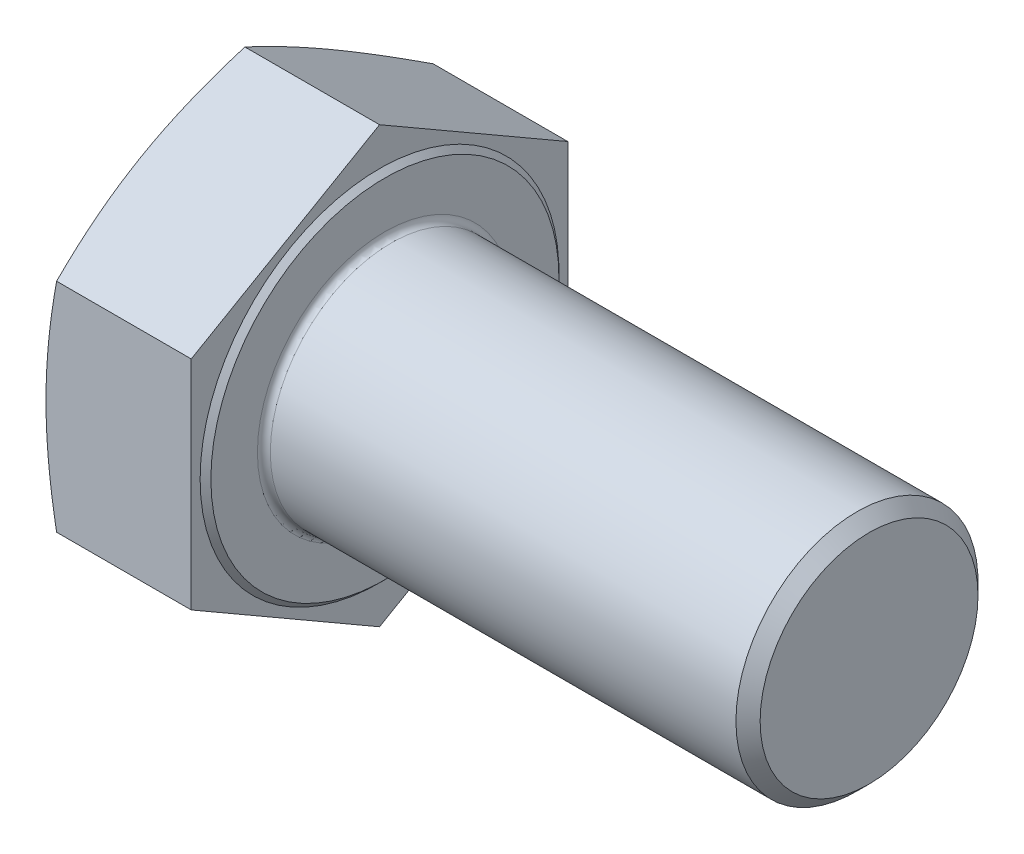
SolidWorks part; units mm, degrees
ref_plane "Front" through (0, 0, 0) normal (0, 0, 1) x (1, 0, 0)
ref_plane "Top" through (0, 0, 0) normal (0, 1, 0) x (1, 0, 0)
ref_plane "Right" through (0, 0, 0) normal (1, 0, 0) x (0, 0, -1)
sketch "Sketch2" plane through (0, 0, 0) normal (1, 0, 0) x (0, 0, -1)
  line L1 (0, -40.4145) -> (35, -20.2073)
  line L2 (35, -20.2073) -> (35, 20.2073)
  line L3 (35, 20.2073) -> (0, 40.4145)
  line L4 (0, 40.4145) -> (-35, 20.2073)
  line L5 (-35, 20.2073) -> (-35, -20.2073)
  line L6 (-35, -20.2073) -> (0, -40.4145)
  circle A0 centre (0, 0) radius 35 construction
  dimension "s" = 70
extrude "BaseHead" add sketch "Sketch2" along normal blind 28
sketch "Sketch3" plane through (0, 0, 0) normal (0, 0, 1) x (1, 0, 0)
  line L0 (28, 40.4145) -> (28, 32.35)
  line L2 (28, 32.35) -> (27, 33.35)
  line L3 (27, 33.35) -> (27, 40.4145)
  line L5 (27, 40.4145) -> (28, 40.4145)
  line L6 (-0.9571, 0) -> (7.6478, 0) construction
  line L7 (28, 40.4145) -> (0, 40.4145) construction
  dimension "D1" = 45
  dimension "c" = 1
  dimension "dw" = 64.7
revolve "BearingFace" cut sketch "Sketch3" angle 360 about L6
sketch "Sketch4" plane through (0, 0, 0) normal (0, 0, 1) x (1, 0, 0)
  line L0 (-0.4935, 0) -> (3.5626, 0) construction
  line L2 (0, 40.4145) -> (1.9707, 40.4145)
  line L4 (1.9707, 40.4145) -> (0, 35)
  line L6 (0, 35) -> (0, 40.4145)
  line L7 (27, 40.4145) -> (0, 40.4145) construction
  dimension "D1" = 20
  dimension "D2" = 70
revolve "HeadChamfer" cut sketch "Sketch4" angle 360 about L0
sketch "Sketch5" plane through (28, 0, 0) normal (1, 0, 0) x (0, 0, -1)
  circle A0 centre (0, 0) radius 22.5
  dimension "d" = 45
extrude "BaseBody" add sketch "Sketch5" along normal blind 90
chamfer "Chamfer1" distance 2.25 angle 45 1 edges at (118, 0, -22.5)
fillet "HeadFillet" radius 1.2 1 edges at (28, 0, 22.5)
equation "\"D2@Sketch4\" = \"s@Sketch2\""
equation "\"D1@Chamfer1\" = 0.05 * \"d@Sketch5\""
